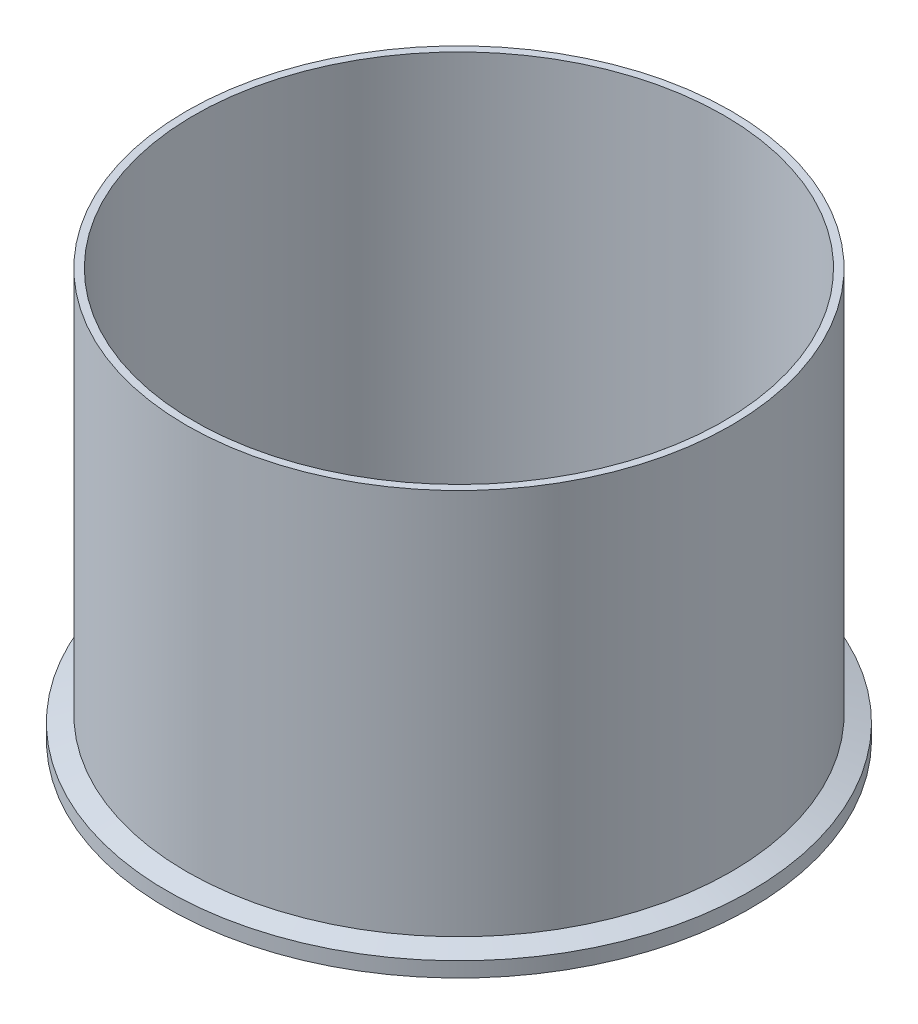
SolidWorks part; units mm, degrees
ref_plane "Front Plane" through (0, 0, 0) normal (0, 0, 1) x (1, 0, 0)
ref_plane "Top Plane" through (0, 0, 0) normal (0, 1, 0) x (1, 0, 0)
ref_plane "Right Plane" through (0, 0, 0) normal (1, 0, 0) x (0, 0, -1)
sketch "Sketch1" plane through (0, 0, 0) normal (0, 0, 1) x (1, 0, 0)
  line L0 (0, 0) -> (0, 152.4) construction
  line L1 (0, 152.4) -> (-101.6, 152.4)
  line L2 (-101.6, 152.4) -> (-101.6, 8.2228)
  line L3 (-101.6, 8.2228) -> (-108.839, 5.588)
  line L4 (-108.839, 5.588) -> (-108.839, 0)
  line L5 (-108.839, 0) -> (-105.3992, 0)
  line L6 (-101.7632, 0) -> (0, 0)
  line L7 (0, 0) -> (0, 152.4)
  line L8 (0, 152.4) -> (-98.8314, 152.4)
  line L9 (-98.8314, 152.4) -> (-98.8314, 0)
  line L10 (-98.8314, 0) -> (0, 0)
  line L11 (0, 0) -> (-0.1846, 0.0129)
  arc A0 (-104.6767, 0.4745) -> (-102.4857, 0.4745) centre (-103.5812, 0) cw
  arc A1 (-101.7632, 0) -> (-102.4857, 0.4745) centre (-101.7632, 0.7874) cw
  arc A2 (-104.6767, 0.4745) -> (-105.3992, 0) centre (-105.3992, 0.7874) cw
  point P12 (-102.3874, 0)
  dimension "D6" = 1.1938
  dimension "D7" = 0.7874
  dimension "D1" = 101.6
  dimension "D2" = 5.588
  dimension "D3" = 108.839
  dimension "D4" = 70
  dimension "D5" = 103.5812
  dimension "D8" = 2.7686
  dimension "D9" = 152.4
  dimension "D10" = 8.2228
revolve "Revolve2" add sketch "Sketch1" angle 360 about L0
